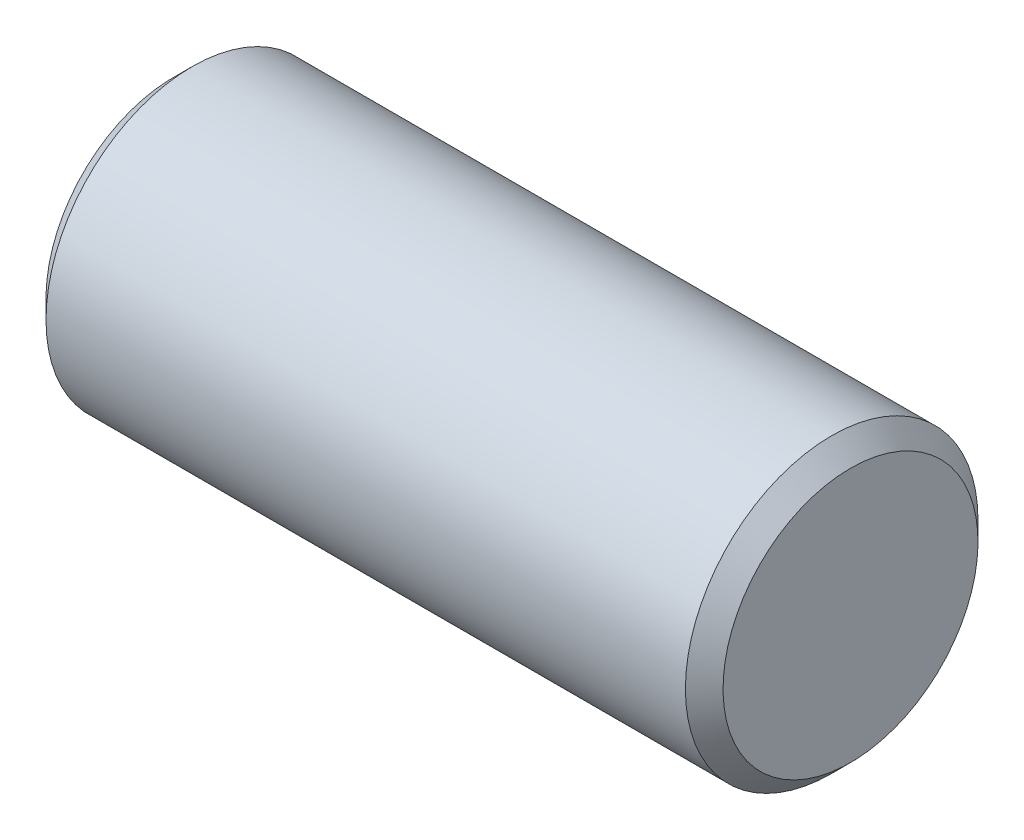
SolidWorks part; units mm, degrees
ref_plane "Front Plane" through (0, 0, 0) normal (0, 0, 1) x (1, 0, 0)
ref_plane "Top Plane" through (0, 0, 0) normal (0, 1, 0) x (1, 0, 0)
ref_plane "Right Plane" through (0, 0, 0) normal (1, 0, 0) x (0, 0, -1)
sketch "Sketch1" plane through (0, 0, 0) normal (0, 0, 1) x (1, 0, 0)
  line L0 (4.57, 0) -> (-4.57, 0)
  line L1 (-4.57, 0) -> (-4.57, 1.975)
  line L2 (-4.57, 1.975) -> (4.57, 1.975)
  line L3 (0, 1.975) -> (0, 0) construction
  line L4 (4.57, 0) -> (4.57, 1.975)
  dimension "D1" = 4.57
  dimension "D2" = 1.975
revolve "Revolve1" add sketch "Sketch1" angle 360 about L0
chamfer "Chamfer1" distance 0.254 angle 45 2 edges at (4.57, 1.975, 0) (-4.57, 1.975, 0)
